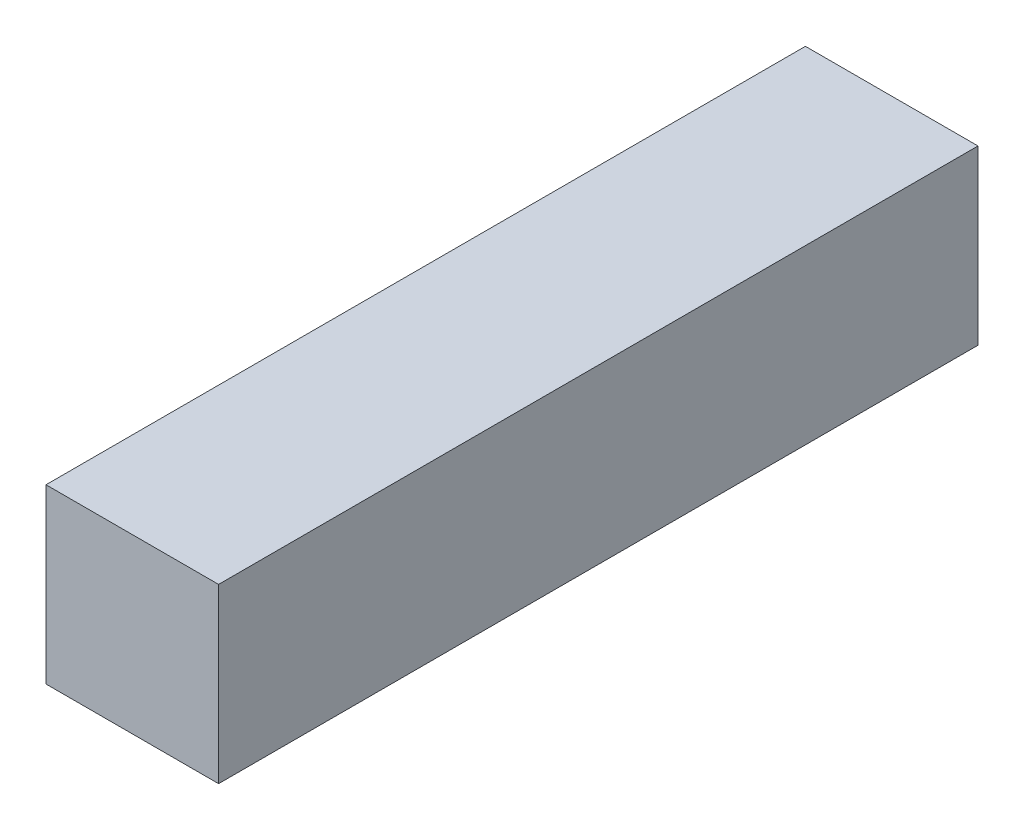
SolidWorks part; units mm, degrees
ref_plane "Plan de face" through (0, 0, 0) normal (0, 0, 1) x (1, 0, 0)
ref_plane "Plan de dessus" through (0, 0, 0) normal (0, 1, 0) x (1, 0, 0)
ref_plane "Plan de droite" through (0, 0, 0) normal (1, 0, 0) x (0, 0, -1)
sketch "Esquisse1" plane through (0, 0, 0) normal (0, 0, 1) x (1, 0, 0)
  line L1 (0, 0) -> (10, 0)
  line L2 (0, 0) -> (0, 10)
  line L3 (0, 10) -> (10, 10)
  line L4 (10, 0) -> (10, 10)
  dimension "D1" = 10
  dimension "D2" = 10
extrude "Extrusion1" add sketch "Esquisse1" along normal blind 44
